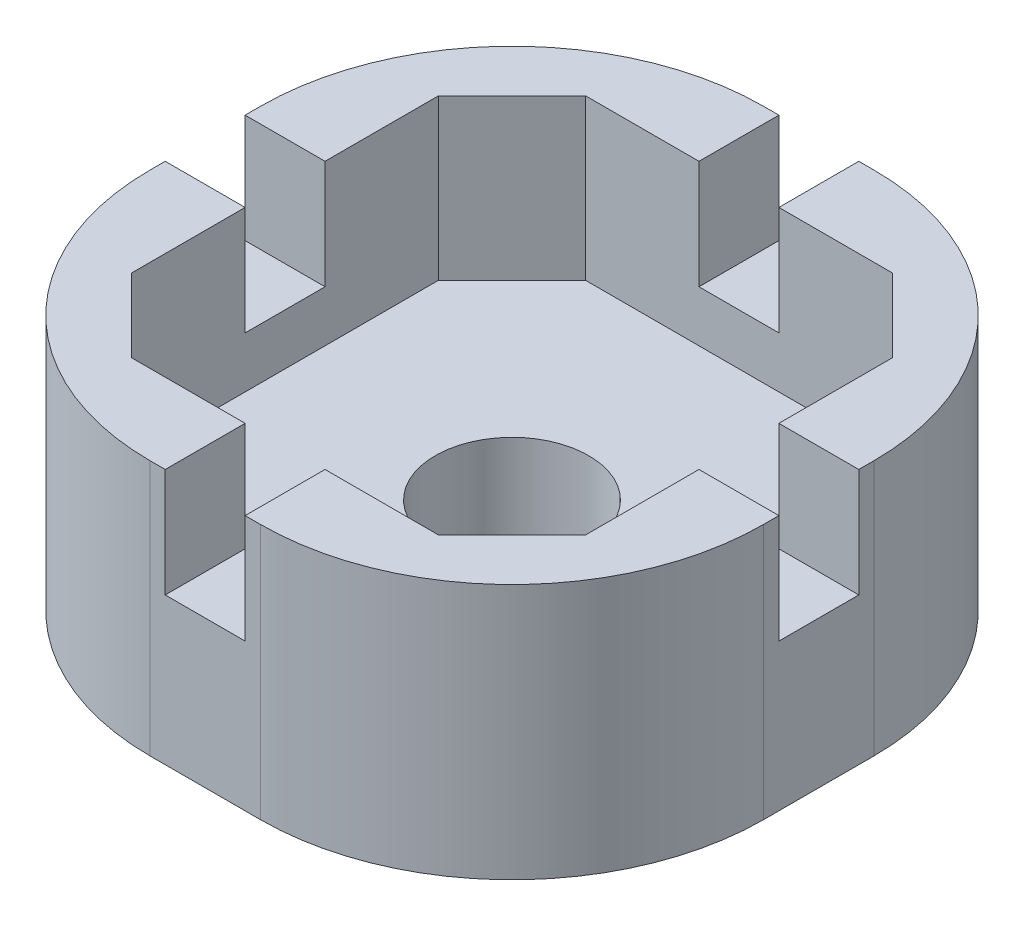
SolidWorks part; units mm, degrees
ref_plane "Front Plane" through (0, 0, 0) normal (0, 0, 1) x (1, 0, 0)
ref_plane "Top Plane" through (0, 0, 0) normal (0, 1, 0) x (1, 0, 0)
ref_plane "Right Plane" through (0, 0, 0) normal (1, 0, 0) x (0, 0, -1)
sketch "Sketch1" plane through (0, 0, 0) normal (0, 1, 0) x (1, 0, 0)
  line L0 (-9.017, 0) -> (9.017, 0) construction
  line L1 (0, 9.017) -> (0, -9.017) construction
  line L2 (-6.096, 9.017) -> (6.096, 9.017)
  line L3 (6.096, 9.017) -> (9.017, 6.096)
  line L4 (9.017, 6.096) -> (9.017, -6.096)
  line L5 (9.017, -6.096) -> (6.096, -9.017)
  line L6 (6.096, -9.017) -> (-6.096, -9.017)
  line L7 (-6.096, -9.017) -> (-9.017, -6.096)
  line L8 (-9.017, -6.096) -> (-9.017, 6.096)
  line L9 (-9.017, 6.096) -> (-6.096, 9.017)
  line L10 (6.096, 9.017) -> (6.096, -9.017) construction
  line L11 (9.017, 6.096) -> (-9.017, 6.096) construction
  line L12 (-12.192, 12.192) -> (-12.192, -12.192)
  line L13 (-12.192, -12.192) -> (12.192, -12.192)
  line L14 (12.192, -12.192) -> (12.192, 12.192)
  line L15 (12.192, 12.192) -> (-12.192, 12.192)
  point P0 (0, 0)
  dimension "D1" = 12.192
  dimension "D2" = 45
  dimension "D3" = 18.034
  dimension "D4" = 3.175
  dimension "D5" = 3.175
  dimension "D6" = 3.175
  dimension "D7" = 3.175
extrude "Boss-Extrude1" add sketch "Sketch1" along normal blind 6.35
sketch "Sketch2" plane through (0, 0, 0) normal (0, -1, 0) x (1, 0, 0)
  line L1 (12.192, 12.192) -> (-12.192, 12.192)
  line L2 (12.192, 12.192) -> (12.192, -12.192)
  line L3 (12.192, -12.192) -> (-12.192, -12.192)
  line L4 (-12.192, 12.192) -> (-12.192, -12.192)
  line L5 (12.192, 12.192) -> (-12.192, -12.192) construction
  line L6 (12.192, -12.192) -> (-12.192, 12.192) construction
  circle A0 centre (0, 0) radius 3.048
  point P4 (0, 0)
  dimension "D1" = 6.096
extrude "Boss-Extrude2" add sketch "Sketch2" along normal blind 3.81
sketch "Sketch3" plane through (0, 6.35, 0) normal (0, 1, 0) x (1, 0, 0)
  line L0 (0, -12.192) -> (0, 12.192) construction
  line L1 (-12.192, -12.192) -> (12.192, -12.192) construction
  line L2 (12.192, 12.192) -> (-12.192, 12.192) construction
  line L3 (12.192, 0) -> (-12.192, 0) construction
  line L4 (12.192, -12.192) -> (12.192, 12.192) construction
  line L5 (-12.192, 12.192) -> (-12.192, -12.192) construction
  line L7 (1.5875, 12.192) -> (-1.5875, 12.192)
  line L8 (1.5875, 12.192) -> (1.5875, -12.192)
  line L9 (1.5875, -12.192) -> (-1.5875, -12.192)
  line L10 (-1.5875, 12.192) -> (-1.5875, -12.192)
  line L11 (1.5875, 12.192) -> (-1.5875, -12.192) construction
  line L12 (1.5875, -12.192) -> (-1.5875, 12.192) construction
  line L13 (12.192, 1.5875) -> (-12.192, 1.5875)
  line L14 (12.192, 1.5875) -> (12.192, -1.5875)
  line L15 (12.192, -1.5875) -> (-12.192, -1.5875)
  line L16 (-12.192, 1.5875) -> (-12.192, -1.5875)
  line L17 (12.192, 1.5875) -> (-12.192, -1.5875) construction
  line L18 (12.192, -1.5875) -> (-12.192, 1.5875) construction
  point P12 (0, 0)
  point P17 (0, 0)
  dimension "D1" = 3.175
extrude "Cut-Extrude1" cut sketch "Sketch3" against normal blind 4.318 contours L10 L8 M19 M9 | L15 L13 M10 M17 | L15 L13 M13 M12 | L10 L8 M11 M15
fillet "Fillet1" radius 10 4 edges at (12.192, 1.27, -12.192) (-12.192, 1.27, -12.192) (-12.192, 1.27, 12.192) (12.192, 1.27, 12.192)
